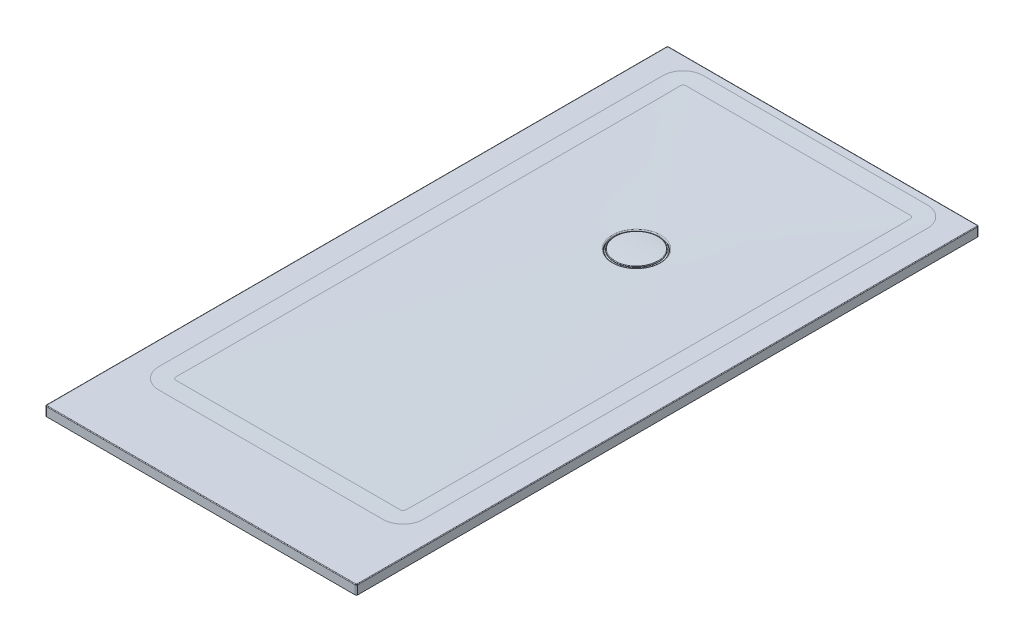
SolidWorks part; units mm, degrees
ref_plane "Płaszczyzna przednia" through (0, 0, 0) normal (0, 0, 1) x (1, 0, 0)
ref_plane "Płaszczyzna górna" through (0, 0, 0) normal (0, 1, 0) x (1, 0, 0)
ref_plane "Płaszczyzna prawa" through (0, 0, 0) normal (1, 0, 0) x (0, 0, -1)
sketch "Szkic2" plane through (0, 0, 0) normal (0, 1, 0) x (1, 0, 0)
  line L0 (0, 1000) -> (0, 400) construction
  line L1 (-500, -1000) -> (500, -1000)
  line L2 (-500, -1000) -> (-500, 1000)
  line L3 (-500, 1000) -> (500, 1000)
  line L4 (500, -1000) -> (500, 1000)
  line L5 (-500, -1000) -> (500, 1000) construction
  line L6 (-500, 1000) -> (500, -1000) construction
  line L7 (-410, 960) -> (410, 960)
  line L8 (-410, 960) -> (-410, -760)
  line L9 (-410, -760) -> (410, -760)
  line L10 (410, 960) -> (410, -760)
  line L11 (-450, 1000) -> (-450, -800) construction
  line L12 (-450, -800) -> (450, -800) construction
  line L13 (450, -800) -> (450, 1000) construction
  circle A0 centre (0, 400) radius 75
  point P0 (0, 0)
  point P11 (0, 960)
  point P16 (0, -800)
  dimension "D9" = 150
  dimension "D1" = 1000
  dimension "D2" = 2000
  dimension "D3" = 40
  dimension "D4" = 90
  dimension "D5" = 40
  dimension "D6" = 50
  dimension "D7" = 1800
  dimension "D8" = 600
  dimension "D10" = 900
sketch "Szkic3" plane through (0, 0, 0) normal (0, 1, 0) x (1, 0, 0)
  line L0 (-500, -1000) -> (-500, 1000) construction
  line L1 (-500, -1000) -> (500, -1000) construction
  line L2 (500, -1000) -> (500, 1000) construction
  line L3 (-500, 1000) -> (500, 1000) construction
  line L4 (-410, 960) -> (-410, -760) construction
  line L5 (-410, 960) -> (410, 960) construction
  line L6 (410, 960) -> (410, -760) construction
  line L7 (-410, -760) -> (410, -760) construction
  line L8 (-500, -1000) -> (-500, 1000)
  line L9 (-500, -1000) -> (500, -1000)
  line L10 (500, -1000) -> (500, 1000)
  line L11 (-500, 1000) -> (500, 1000)
  line L12 (-410, 910) -> (-410, -710)
  line L13 (-360, 960) -> (360, 960)
  line L14 (410, 910) -> (410, -710)
  line L15 (-360, -760) -> (360, -760)
  arc A0 (410, 910) -> (360, 960) centre (360, 910) ccw
  arc A1 (-360, 960) -> (-410, 910) centre (-360, 910) ccw
  arc A2 (360, -760) -> (410, -710) centre (360, -710) ccw
  arc A3 (-360, -760) -> (-410, -710) centre (-360, -710) cw
  dimension "D1" = 50
surface "Powierzchnia-Płaszczyzna1" sketch "Szkic3"
sketch "Szkic4" plane through (0, 0, 0) normal (0, 1, 0) x (1, 0, 0)
  line L0 (-410, 960) -> (-410, -760) construction
  line L1 (-410, -760) -> (410, -760) construction
  line L2 (410, 960) -> (410, -760) construction
  line L3 (-410, 960) -> (410, 960) construction
  line L4 (-410, 960) -> (-410, -760)
  line L5 (-410, -760) -> (410, -760)
  line L6 (410, 960) -> (410, -760)
  line L7 (-410, 960) -> (410, 960)
ref_plane "korek" through (0, -15, 0) normal (0, 1, 0) x (-1, 0, 0)
sketch "Szkic5" plane through (0, -15, 0) normal (0, 1, 0) x (-1, 0, 0)
  circle A0 centre (0, -400) radius 75 construction
  circle A1 centre (0, -400) radius 75
surface "Powierzchnia-Wyciągnięcie po profilach2"
surface "Powierzchnia-Połącz1"
sketch "Szkic7" plane through (0, 0, 0) normal (0, 1, 0) x (1, 0, 0)
  line L27 (360, 920) -> (-360, 920)
  line L28 (-370, 910) -> (-370, -710)
  line L29 (-360, -720) -> (360, -720)
  line L30 (370, -710) -> (370, 910)
  line L31 (360, 920) -> (-360, 920)
  line L32 (-370, 910) -> (-370, -710)
  line L33 (-360, -720) -> (360, -720)
  line L34 (370, -710) -> (370, 910)
  line L35 (360, 975) -> (-360, 975)
  line L36 (-425, 910) -> (-425, -710)
  line L37 (-360, -775) -> (360, -775)
  line L38 (425, -710) -> (425, 910)
  line L39 (360, 975) -> (-360, 975)
  line L40 (-425, 910) -> (-425, -710)
  line L41 (-360, -775) -> (360, -775)
  line L42 (425, -710) -> (425, 910)
  arc A0 (370, -710) -> (360, -720) centre (360, -710) cw
  arc A1 (-370, -710) -> (-360, -720) centre (-360, -710) ccw
  arc A2 (370, 910) -> (360, 920) centre (360, 910) ccw
  arc A3 (-370, 910) -> (-360, 920) centre (-360, 910) cw
  spline S23 degree 3 poles (-590.6353, 632.1923) (168.8073, 800.2538) (377.2673, 874.486) (369.7449, 912.2675) (369.6659, 912.5842) (369.4758, 913.2121) (369.3642, 913.5242) (368.9881, 914.432) (368.6814, 915.0061) (368.1377, 915.821) (367.9418, 916.0858) (367.5239, 916.5953) (367.3041, 916.8378) (366.6128, 917.5297) (366.1099, 917.9436) (365.2909, 918.4921) (365.007, 918.6624) (364.4302, 918.9711) (364.1357, 919.1106) (363.5345, 919.3602) (363.228, 919.4704) (362.6025, 919.6609) (362.2823, 919.7416) (317.1244, 928.7705) (237.7347, 627.088) (116.5963, -49.9162) knots -7.207674 -7.207674 -7.207674 -7.207674 0.125 0.125 0.1875 0.1875 0.25 0.25 0.375 0.375 0.4375 0.4375 0.5 0.5 0.625 0.625 0.6875 0.6875 0.75 0.75 0.8125 0.8125 0.875 0.875 9.551453 9.551453 9.551453 9.551453 only from (370, 910) to (360, 920)
  spline S24 degree 3 poles (-88.3133, -42.3838) (-258.6017, 742.6747) (-326.5562, 926.8424) (-362.2675, 919.7449) (-362.5842, 919.6658) (-363.2121, 919.4758) (-363.5242, 919.3641) (-364.432, 918.9882) (-365.0061, 918.6813) (-365.821, 918.1377) (-366.0858, 917.9418) (-366.5953, 917.5239) (-366.8379, 917.3041) (-367.5296, 916.6128) (-367.9436, 916.1099) (-368.492, 915.2909) (-368.6623, 915.0071) (-368.9711, 914.4303) (-369.1105, 914.1357) (-369.3602, 913.5346) (-369.4703, 913.228) (-369.661, 912.6026) (-369.7415, 912.2823) (-380.5687, 858.2361) (58.3796, 754.4868) (592.8873, 640.1074) knots -6.802039 -6.802039 -6.802039 -6.802039 0.125 0.125 0.1875 0.1875 0.25 0.25 0.375 0.375 0.4375 0.4375 0.5 0.5 0.625 0.625 0.6875 0.6875 0.75 0.75 0.8125 0.8125 0.875 0.875 11.271829 11.271829 11.271829 11.271829 only from (-360, 920) to (-370, 910)
  spline S25 degree 3 poles (590.6353, -432.1923) (-168.8073, -600.2538) (-377.2673, -674.486) (-369.7449, -712.2675) (-369.6659, -712.5842) (-369.4758, -713.2121) (-369.3642, -713.5242) (-368.9881, -714.432) (-368.6814, -715.0061) (-368.1377, -715.821) (-367.9418, -716.0858) (-367.5239, -716.5953) (-367.3041, -716.8378) (-366.6128, -717.5297) (-366.1099, -717.9436) (-365.2909, -718.4921) (-365.007, -718.6624) (-364.4302, -718.9711) (-364.1357, -719.1106) (-363.5345, -719.3602) (-363.228, -719.4704) (-362.6025, -719.6609) (-362.2823, -719.7416) (-317.1244, -728.7705) (-237.7347, -427.088) (-116.5962, 249.9166) knots -7.207674 -7.207674 -7.207674 -7.207674 0.125 0.125 0.1875 0.1875 0.25 0.25 0.375 0.375 0.4375 0.4375 0.5 0.5 0.625 0.625 0.6875 0.6875 0.75 0.75 0.8125 0.8125 0.875 0.875 9.551453 9.551453 9.551453 9.551453 only from (-370, -710) to (-360, -720)
  spline S26 degree 3 poles (88.3133, 242.3839) (258.6017, -542.6747) (326.5562, -726.8424) (362.2675, -719.7449) (362.5842, -719.6658) (363.2121, -719.4758) (363.5242, -719.3641) (364.432, -718.9882) (365.0061, -718.6813) (365.821, -718.1377) (366.0858, -717.9418) (366.5953, -717.5239) (366.8379, -717.3041) (367.5296, -716.6128) (367.9436, -716.1099) (368.492, -715.2909) (368.6623, -715.0071) (368.9711, -714.4303) (369.1105, -714.1357) (369.3602, -713.5346) (369.4703, -713.228) (369.661, -712.6026) (369.7415, -712.2823) (380.5687, -658.2361) (-58.3796, -554.4868) (-592.8873, -440.1074) knots -6.802039 -6.802039 -6.802039 -6.802039 0.125 0.125 0.1875 0.1875 0.25 0.25 0.375 0.375 0.4375 0.4375 0.5 0.5 0.625 0.625 0.6875 0.6875 0.75 0.75 0.8125 0.8125 0.875 0.875 11.271829 11.271829 11.271829 11.271829 only from (360, -720) to (370, -710)
  spline S31 degree 3 poles (-2396.2782, -67.948) (-146.1063, 485.3734) (456.4507, 758.1095) (423.3422, 924.7389) (422.8284, 926.7972) (421.9015, 929.8582) (421.5658, 930.8758) (420.8441, 932.8943) (420.4597, 933.8906) (418.4228, 938.8081) (416.4285, 942.54) (413.4837, 946.9543) (412.8719, 947.8245) (411.6021, 949.5394) (410.9422, 950.3861) (408.9053, 952.8702) (407.4763, 954.4465) (402.9828, 958.9433) (399.7136, 961.634) (395.2774, 964.6044) (394.37, 965.1802) (392.5354, 966.2813) (391.608, 966.8072) (388.7959, 968.3122) (386.8814, 969.2188) (382.974, 970.8413) (380.9812, 971.5574) (377.9323, 972.4865) (376.9061, 972.7721) (374.8334, 973.2939) (373.785, 973.5304) (178.33, 1012.5866) (-115.6901, 155.0136) (-539.4913, -1870.4434) knots -4.829892 -4.829892 -4.829892 -4.829892 0.125 0.125 0.1875 0.1875 0.21875 0.21875 0.25 0.25 0.375 0.375 0.40625 0.40625 0.4375 0.4375 0.5 0.5 0.625 0.625 0.65625 0.65625 0.6875 0.6875 0.75 0.75 0.8125 0.8125 0.84375 0.84375 0.875 0.875 6.662865 6.662865 6.662865 6.662865 only from (425, 910) to (360, 975)
  spline S32 degree 3 poles (614.9668, -1847.3647) (61.2061, 411.8322) (-209.0988, 1006.2455) (-374.7389, 973.3422) (-376.7973, 972.8282) (-379.8583, 971.9014) (-380.8759, 971.5658) (-382.8944, 970.844) (-383.8907, 970.4596) (-388.8082, 968.4228) (-392.54, 966.4285) (-396.9544, 963.4836) (-397.8246, 962.8719) (-399.5395, 961.602) (-400.3862, 960.9422) (-402.8703, 958.9052) (-404.4465, 957.4763) (-408.9432, 952.9827) (-411.6339, 949.7136) (-414.6044, 945.2774) (-415.1802, 944.3699) (-416.2813, 942.5354) (-416.8072, 941.608) (-418.3122, 938.7959) (-419.2188, 936.8814) (-420.8414, 932.974) (-421.5573, 930.9812) (-422.4865, 927.9323) (-422.772, 926.9061) (-423.2939, 924.8334) (-423.5304, 923.785) (-463.069, 725.9723) (417.0227, 427.0055) (2418.1798, 3.4199) knots -4.800031 -4.800031 -4.800031 -4.800031 0.125 0.125 0.1875 0.1875 0.21875 0.21875 0.25 0.25 0.375 0.375 0.40625 0.40625 0.4375 0.4375 0.5 0.5 0.625 0.625 0.65625 0.65625 0.6875 0.6875 0.75 0.75 0.8125 0.8125 0.84375 0.84375 0.875 0.875 6.733125 6.733125 6.733125 6.733125 only from (-360, 975) to (-425, 910)
  spline S33 degree 3 poles (2396.2782, 267.948) (146.1063, -285.3734) (-456.4507, -558.1095) (-423.3422, -724.7389) (-422.8284, -726.7972) (-421.9015, -729.8582) (-421.5658, -730.8758) (-420.8441, -732.8943) (-420.4597, -733.8906) (-418.4228, -738.8081) (-416.4285, -742.54) (-413.4837, -746.9543) (-412.8719, -747.8245) (-411.6021, -749.5394) (-410.9422, -750.3861) (-408.9053, -752.8702) (-407.4763, -754.4465) (-402.9828, -758.9433) (-399.7136, -761.634) (-395.2774, -764.6044) (-394.37, -765.1802) (-392.5354, -766.2813) (-391.608, -766.8072) (-388.7959, -768.3122) (-386.8814, -769.2188) (-382.974, -770.8413) (-380.9812, -771.5574) (-377.9323, -772.4865) (-376.9061, -772.7721) (-374.8334, -773.2939) (-373.785, -773.5304) (-178.33, -812.5866) (115.6901, 44.9864) (539.4913, 2070.4435) knots -4.829892 -4.829892 -4.829892 -4.829892 0.125 0.125 0.1875 0.1875 0.21875 0.21875 0.25 0.25 0.375 0.375 0.40625 0.40625 0.4375 0.4375 0.5 0.5 0.625 0.625 0.65625 0.65625 0.6875 0.6875 0.75 0.75 0.8125 0.8125 0.84375 0.84375 0.875 0.875 6.662865 6.662865 6.662865 6.662865 only from (-425, -710) to (-360, -775)
  spline S34 degree 3 poles (-614.9668, 2047.3647) (-61.2061, -211.8322) (209.0988, -806.2455) (374.7389, -773.3422) (376.7973, -772.8282) (379.8583, -771.9014) (380.8759, -771.5658) (382.8944, -770.844) (383.8907, -770.4596) (388.8082, -768.4228) (392.54, -766.4285) (396.9544, -763.4836) (397.8246, -762.8719) (399.5395, -761.602) (400.3862, -760.9422) (402.8703, -758.9052) (404.4465, -757.4763) (408.9432, -752.9827) (411.6339, -749.7136) (414.6044, -745.2774) (415.1802, -744.3699) (416.2813, -742.5354) (416.8072, -741.608) (418.3122, -738.7959) (419.2188, -736.8814) (420.8414, -732.974) (421.5573, -730.9812) (422.4865, -727.9323) (422.772, -726.9061) (423.2939, -724.8334) (423.5304, -723.785) (463.069, -525.9723) (-417.0227, -227.0055) (-2418.1798, 196.5801) knots -4.800031 -4.800031 -4.800031 -4.800031 0.125 0.125 0.1875 0.1875 0.21875 0.21875 0.25 0.25 0.375 0.375 0.40625 0.40625 0.4375 0.4375 0.5 0.5 0.625 0.625 0.65625 0.65625 0.6875 0.6875 0.75 0.75 0.8125 0.8125 0.84375 0.84375 0.875 0.875 6.733125 6.733125 6.733125 6.733125 only from (360, -775) to (425, -710)
  spline S35 degree 3 poles (425, 910) (425, 914.2918) (424.5795, 918.5119) (423.3422, 924.7389) (422.8284, 926.7972) (421.9015, 929.8582) (421.5658, 930.8758) (420.8441, 932.8943) (420.4597, 933.8906) (418.4228, 938.8081) (416.4285, 942.54) (413.4837, 946.9543) (412.8719, 947.8245) (411.6021, 949.5394) (410.9422, 950.3861) (408.9053, 952.8702) (407.4763, 954.4465) (402.9828, 958.9433) (399.7136, 961.634) (395.2774, 964.6044) (394.37, 965.1802) (392.5354, 966.2813) (391.608, 966.8072) (388.7959, 968.3122) (386.8814, 969.2188) (382.974, 970.8413) (380.9812, 971.5574) (377.9323, 972.4865) (376.9061, 972.7721) (374.8334, 973.2939) (373.785, 973.5304) (368.5368, 974.5792) (364.2918, 975) (360, 975) knots 0 0 0 0 0.125 0.125 0.1875 0.1875 0.21875 0.21875 0.25 0.25 0.375 0.375 0.40625 0.40625 0.4375 0.4375 0.5 0.5 0.625 0.625 0.65625 0.65625 0.6875 0.6875 0.75 0.75 0.8125 0.8125 0.84375 0.84375 0.875 0.875 1 1 1 1
  spline S36 degree 3 poles (-360, 975) (-364.2918, 975) (-368.5119, 974.5792) (-374.7389, 973.3422) (-376.7973, 972.8282) (-379.8583, 971.9014) (-380.8759, 971.5658) (-382.8944, 970.844) (-383.8907, 970.4596) (-388.8082, 968.4228) (-392.54, 966.4285) (-396.9544, 963.4836) (-397.8246, 962.8719) (-399.5395, 961.602) (-400.3862, 960.9422) (-402.8703, 958.9052) (-404.4465, 957.4763) (-408.9432, 952.9827) (-411.6339, 949.7136) (-414.6044, 945.2774) (-415.1802, 944.3699) (-416.2813, 942.5354) (-416.8072, 941.608) (-418.3122, 938.7959) (-419.2188, 936.8814) (-420.8414, 932.974) (-421.5573, 930.9812) (-422.4865, 927.9323) (-422.772, 926.9061) (-423.2939, 924.8334) (-423.5304, 923.785) (-424.5794, 918.5368) (-425, 914.2918) (-425, 910) knots 0 0 0 0 0.125 0.125 0.1875 0.1875 0.21875 0.21875 0.25 0.25 0.375 0.375 0.40625 0.40625 0.4375 0.4375 0.5 0.5 0.625 0.625 0.65625 0.65625 0.6875 0.6875 0.75 0.75 0.8125 0.8125 0.84375 0.84375 0.875 0.875 1 1 1 1
  spline S37 degree 3 poles (-425, -710) (-425, -714.2918) (-424.5795, -718.5119) (-423.3422, -724.7389) (-422.8284, -726.7972) (-421.9015, -729.8582) (-421.5658, -730.8758) (-420.8441, -732.8943) (-420.4597, -733.8906) (-418.4228, -738.8081) (-416.4285, -742.54) (-413.4837, -746.9543) (-412.8719, -747.8245) (-411.6021, -749.5394) (-410.9422, -750.3861) (-408.9053, -752.8702) (-407.4763, -754.4465) (-402.9828, -758.9433) (-399.7136, -761.634) (-395.2774, -764.6044) (-394.37, -765.1802) (-392.5354, -766.2813) (-391.608, -766.8072) (-388.7959, -768.3122) (-386.8814, -769.2188) (-382.974, -770.8413) (-380.9812, -771.5574) (-377.9323, -772.4865) (-376.9061, -772.7721) (-374.8334, -773.2939) (-373.785, -773.5304) (-368.5368, -774.5792) (-364.2918, -775) (-360, -775) knots 0 0 0 0 0.125 0.125 0.1875 0.1875 0.21875 0.21875 0.25 0.25 0.375 0.375 0.40625 0.40625 0.4375 0.4375 0.5 0.5 0.625 0.625 0.65625 0.65625 0.6875 0.6875 0.75 0.75 0.8125 0.8125 0.84375 0.84375 0.875 0.875 1 1 1 1
  spline S38 degree 3 poles (360, -775) (364.2918, -775) (368.5119, -774.5792) (374.7389, -773.3422) (376.7973, -772.8282) (379.8583, -771.9014) (380.8759, -771.5658) (382.8944, -770.844) (383.8907, -770.4596) (388.8082, -768.4228) (392.54, -766.4285) (396.9544, -763.4836) (397.8246, -762.8719) (399.5395, -761.602) (400.3862, -760.9422) (402.8703, -758.9052) (404.4465, -757.4763) (408.9432, -752.9827) (411.6339, -749.7136) (414.6044, -745.2774) (415.1802, -744.3699) (416.2813, -742.5354) (416.8072, -741.608) (418.3122, -738.7959) (419.2188, -736.8814) (420.8414, -732.974) (421.5573, -730.9812) (422.4865, -727.9323) (422.772, -726.9061) (423.2939, -724.8334) (423.5304, -723.785) (424.5794, -718.5368) (425, -714.2918) (425, -710) knots 0 0 0 0 0.125 0.125 0.1875 0.1875 0.21875 0.21875 0.25 0.25 0.375 0.375 0.40625 0.40625 0.4375 0.4375 0.5 0.5 0.625 0.625 0.65625 0.65625 0.6875 0.6875 0.75 0.75 0.8125 0.8125 0.84375 0.84375 0.875 0.875 1 1 1 1
  dimension "D3" = 10
  dimension "D1" = 40
  dimension "D2" = 15
other "Usuń ścianę1"
other "Granica-Powierzchnia1"
surface "Powierzchnia-Połącz2"
sketch "Szkic9" plane through (0, 0, 0) normal (0, 1, 0) x (1, 0, 0)
  line L0 (-500, -1000) -> (500, -1000) construction
  line L1 (-500, -1000) -> (-500, 1000) construction
  line L2 (500, -1000) -> (500, 1000) construction
  line L3 (-500, 1000) -> (500, 1000) construction
  line L4 (-500, -1000) -> (500, -1000)
  line L5 (-500, -1000) -> (-500, 1000)
  line L6 (500, -1000) -> (500, 1000)
  line L7 (-500, 1000) -> (500, 1000)
surface "Powierzchnia-Wyciągnięcie1" sketch "Szkic9" parameters "D1"=30
sketch "Szkic8" plane through (0, 0, 0) normal (1, 0, 0) x (0, 0, -1)
  line L0 (400, 0) -> (400, -30) construction
  line L1 (325, -15) -> (325.2968, -23.5)
  line L4 (325.2968, -23.5) -> (348, -24.0945)
  line L5 (325.2968, -23.5) -> (400, -23.5) construction
  line L6 (348, -24.0945) -> (348, -30) construction
  line L7 (400, -30) -> (325.2968, -30) construction
  line L8 (325.2968, -30) -> (325.2968, -23.5) construction
  line L9 (355, -28) -> (355, -30)
  line L10 (348, -24.0945) -> (355, -28)
  dimension "D1" = 30
  dimension "D2" = 8.5
  dimension "D3" = 2
  dimension "D4" = 1.5
  dimension "D5" = 52
  dimension "D6" = 45
  dimension "D7" = 2
surface "Powierzchnia-Obrót1" sketch "Szkic8" parameters "D1"=360
surface "Powierzchnia-Płaszczyzna2"
surface "Powierzchnia-Połącz3"
fillet "Zaokrąglenie4" radius 4 4 edges at (-500, -15, -1000) (500, -15, -1000) (-500, -15, 1000) (500, -15, 1000)
fillet "Zaokrąglenie5" radius 3 3 edges at (0, -24.0945, -452) (0, -23.5, -474.7032)
fillet "Zaokrąglenie6" radius 2 9 edges at (498.8284, 0, 998.8284) (0, 0, 1000) (-498.8284, 0, 998.8284) (-500, 0, 0) (-498.8284, 0, -998.8284) (0, 0, -1000) (498.8284, 0, -998.8284) (500, 0, 0) (0, -28, -445)
sketch "Szkic11" plane through (0, 0, 0) normal (1, 0, 0) x (0, 0, -1)
  line L0 (400, 0) -> (400, -30) construction
  line L1 (-996, -30) -> (996, -30) construction
  line L2 (400, -17) -> (400, -11.5)
  line L14 (470, -11.5) -> (470, -14.5) construction
  line L16 (470, -17) -> (400, -17)
  line L18 (470, -17) -> (470, -16.3377)
  line L19 (400, -11.5) -> (470, -11.5) construction
  arc A0 (470, -16.3377) -> (468.1666, -14.3446) centre (468, -16.3377) ccw
  arc A6 (468.1666, -14.3446) -> (400, -11.5) centre (400, -829.6667) ccw
  dimension "D2" = 2
  dimension "D8" = 2.5
  dimension "D9" = 17
  dimension "D10" = 5.5
  dimension "D11" = 70
revolve "Obrót1" add sketch "Szkic11" angle 360 about L0
